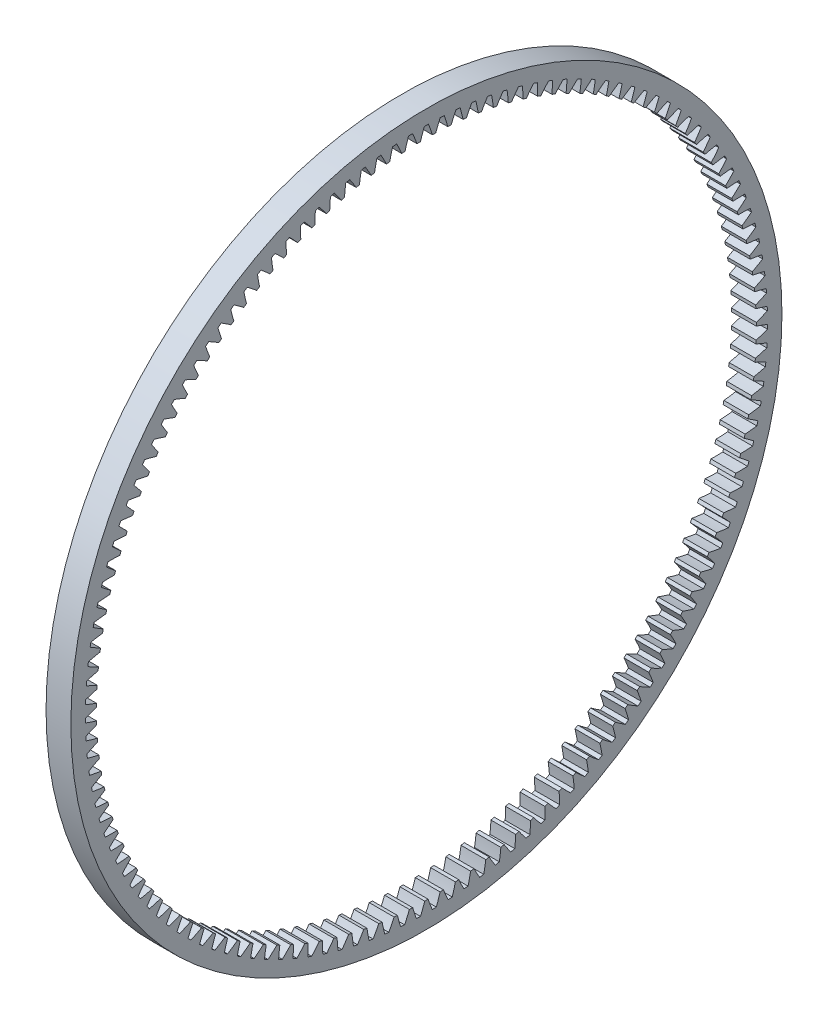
SolidWorks part; units mm, degrees
ref_plane "Plane1" through (0, 0, 0) normal (0, 0, 1) x (1, 0, 0)
ref_plane "Plane2" through (0, 0, 0) normal (0, 1, 0) x (1, 0, 0)
ref_plane "Plane3" through (0, 0, 0) normal (1, 0, 0) x (0, 0, -1)
other "Configuration Table"
sketch "HoldingSke" plane through (0, 0, 0) normal (0, 1, 0) x (1, 0, 0)
  line L0 (0, 0) -> (-0.2357, -0.2357)
  line L1 (-15, 0) -> (100, 0) construction
  line L2 (0, 0) -> (-2.1039, 2.3779)
  line L3 (0, 0) -> (-11.863, 4.5341)
  line L4 (0, 0) -> (-6.1066, 6.1066)
  line L5 (0, 0) -> (-23.7986, -8.8762)
  line L6 (0, 0) -> (-10.5278, -7.1032)
  line L7 (-2.1039, 2.3779) -> (3.3635, 27.1825)
  line L8 (-76.2, 5.3779) -> (-54.61, 5.3779)
  line L9 (-71.009, 38.7566) -> (-53.1078, 45.2721)
  line L10 (-76.2, 71.12) -> (104.1128, 71.12)
  line L11 (0, 0) -> (-15, 0)
  line L12 (-76.2, 101.6) -> (-76.093, 101.6)
  line L13 (24.9733, 27.94) -> (52.9518, 28.4284)
  line L14 (24.9733, 27.94) -> (24.9743, 27.94)
  line L15 (24.9733, 27.94) -> (100.4006, 29.5858)
  circle A0 centre (0, 0) radius 215
  circle A1 centre (0, 0) radius 12.7
  circle A2 centre (0, 0) radius 12.7
sketch "BasProSke" plane through (0, 0, 0) normal (0, 1, 0) x (1, 0, 0)
  line L0 (-10, 0) -> (60, 0) construction
  line L1 (0, 199.5) -> (0, 215)
  line L2 (0, 199.5) -> (15, 199.5)
  line L3 (15, 199.5) -> (15, 215)
  line L4 (15, 215) -> (0, 215)
revolve "Base-Revolve" add sketch "BasProSke" angle 360 about L0
sketch "TooCutSke" plane through (0, 0, 0) normal (1, 0, 0) x (0, 0, -1)
  line L3 (2.6236, 202.483) -> (2.6236, 53.6633) construction
  line L4 (0, 0) -> (0, 59.563) construction
  line L5 (0, 0) -> (-1.5899, 68.309) construction
  line L6 (-92.9791, 169.1412) -> (33.8475, 172.0932) construction
  circle A0 centre (0, 0) radius 202.5 construction
  circle A1 centre (0, 0) radius 206.251 construction
  circle A2 centre (0, 0) radius 171.259 construction
  circle A3 centre (0, 0) radius 199.4746 construction
  arc A4 (3.6307, 199.4416) -> (1.2265, 206.2474) centre (-92.9791, 169.1412) ccw
  arc A5 (3.6307, 199.4416) -> (-3.6307, 199.4416) centre (0, 0) ccw
  arc A6 (1.2265, 206.2474) -> (-1.2265, 206.2474) centre (0, 0) ccw
  arc A7 (-1.2265, 206.2474) -> (-3.6307, 199.4416) centre (92.9791, 169.1412) ccw
extrude "ToothCut" cut sketch "TooCutSke" along normal through all
fillet "Breaks" [suppressed] radius 0.3
fillet "RootFillets" [suppressed] radius 0.751
pattern_circular "TeethCuts" count 135 every 2.667 about axis through (-10, 0, 0) along (1, 0, 0) of "ToothCut"
equation "' \"Module@HoldingSke\" = 6.35"
equation "' \"Num_teeth@HoldingSke\" = 24"
equation "' \"Ap@HoldingSke\" =  14.5"
equation "' \"Ap@HoldingSke\" = 14.5"
equation "' \"Width@HoldingSke\" = 12"
equation "' \"Diameter@HoldingSke\" = 8 * 25.4"
equation "' \"Show_teeth@HoldingSke\" = 100"
equation "' \"Backlash@HoldingSke\" = 0.009 * 25.4"
equation "' \"Addendum_fac@HoldingSke\" = 1.0"
equation "' \"Dedendum_fac@HoldingSke\" = 1.25"
equation "' \"Dedendum_add@HoldingSke\" = 0.00005 * 25.4"
equation "' \"Clearance_fac@HoldingSke\" = 0.25"
equation "\"Pitch@HoldingSke\" = 1 / \"Module@HoldingSke\" "
equation "\"Overcut_dia@TooCutSke\" = (\"Num_teeth@HoldingSke\" - 2 * \"Addendum_fac@HoldingSke\") / \"Pitch@HoldingSke\" - 0.002 * 25.4"
equation "\"Pitch_dia@TooCutSke\" = \"Num_teeth@HoldingSke\" / \"Pitch@HoldingSke\""
equation "\"Base_dia@TooCutSke\" = \"Num_teeth@HoldingSke\" / \"Pitch@HoldingSke\" * cos((\"Ap@HoldingSke\"  * 3.14159265 / 180)) * 0.90"
equation "\"Root_dia@TooCutSke\" = \"Num_teeth@HoldingSke\"  / \"Pitch@HoldingSke\" + 2 *  \"Dedendum_fac@HoldingSke\"/ \"Pitch@HoldingSke\" + \"Dedendum_add@HoldingSke\" * 2"
equation "\"Half_ang@TooCutSke\" = 180 / \"Num_teeth@HoldingSke\""
equation "\"Half_CT@TooCutSke\" = \"Num_teeth@HoldingSke\" / \"Pitch@HoldingSke\" * sin((3.14159265 / 2 / \"Num_teeth@HoldingSke\")) / 2 + 10 * \"Backlash@HoldingSke\" / 4"
equation "\"Flank_rad@TooCutSke\" = \"Num_teeth@HoldingSke\" / \"Pitch@HoldingSke\" / 4"
equation "\"Radius@RootFillets\"= \"Clearance_fac@HoldingSke\" / \"Pitch@HoldingSke\" + \"Dedendum_add@HoldingSke\""
equation "\"Break_rad@Breaks\" = 0.02 / \"Pitch@HoldingSke\" * 5"
equation "\"Num_teeth@TeethCuts\" = int( \"Show_teeth@HoldingSke\" ) + 1"
equation "\"Num_teeth@TeethCuts\" = ((sgn( \"Num_teeth@TeethCuts\" - \"Num_teeth@HoldingSke\" )-1)*( \"Num_teeth@TeethCuts\" - \"Num_teeth@HoldingSke\" ))/-2+ \"Num_teeth@HoldingSke\""
equation "\"Num_teeth@TeethCuts\" = ((sgn( \"Num_teeth@TeethCuts\" - 2.0)+1)*( \"Num_teeth@TeethCuts\" - 2.0))/2 +2.0"
equation "\"Angle@TeethCuts\" = 360.0 / \"Num_teeth@HoldingSke\""
equation "\"Diameter@BasProSke\" = \"Num_teeth@HoldingSke\"  / \"Pitch@HoldingSke\" + 2 *  \"Dedendum_fac@HoldingSke\"/ \"Pitch@HoldingSke\" + \"Dedendum_add@HoldingSke\" * 2 + 0.002 * 25.4"
equation "\"Diameter@BasProSke\" = ((sgn( \"Diameter@BasProSke\"  - \"Diameter@HoldingSke\" )+1)*( \"Diameter@BasProSke\"  - \"Diameter@HoldingSke\" ))/2 + \"Diameter@HoldingSke\""
equation "\"Inside_diameter@BasProSke\" =  (\"Num_teeth@HoldingSke\" - 2 * \"Addendum_fac@HoldingSke\") / \"Pitch@HoldingSke\" "
equation "\"Thickness@BasProSke\"  = \"Width@HoldingSke\""
